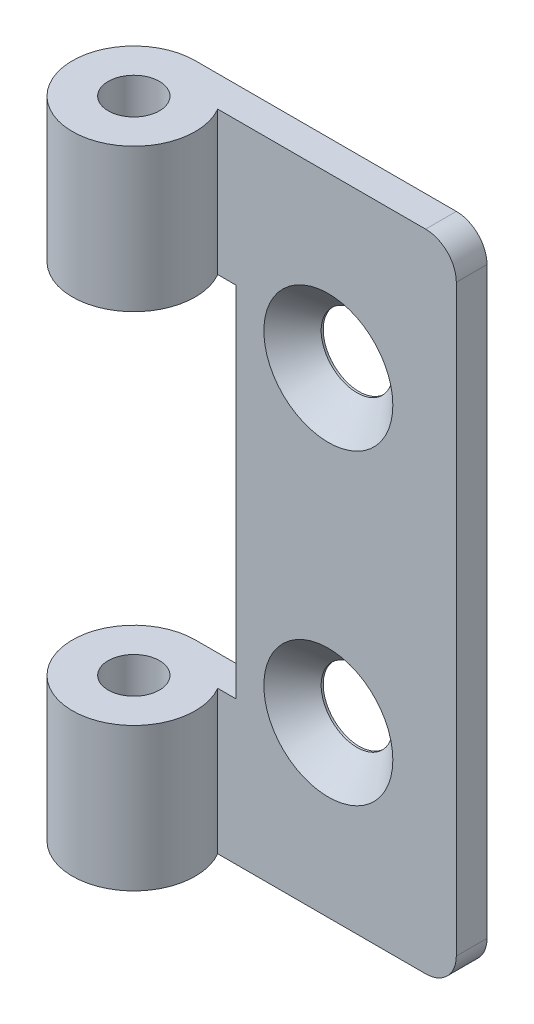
SolidWorks part; units mm, degrees
ref_plane "正面" through (0, 0, 0) normal (0, 0, 1) x (1, 0, 0)
ref_plane "平面" through (0, 0, 0) normal (0, 1, 0) x (1, 0, 0)
ref_plane "右側面" through (0, 0, 0) normal (1, 0, 0) x (0, 0, -1)
sketch "ｽｹｯﾁ1" plane through (0, 0, 0) normal (0, 1, 0) x (1, 0, 0)
  line L1 (0, 6) -> (28.5, 6)
  line L3 (5.1962, 3) -> (28.5, 3)
  line L4 (28.5, 6) -> (28.5, 3)
  arc A0 (0, 6) -> (5.1962, 3) centre (0, 0) ccw
  dimension "D1" = 3
  dimension "D2" = 28.5
extrude "押し出し1" add sketch "ｽｹｯﾁ1" along normal mid plane 63
sketch "ｽｹｯﾁ2" plane through (0, 0, -6) normal (0, 0, -1) x (-1, 0, 0)
  line L1 (6, 31.5) -> (-6, 31.5) construction
  line L2 (11.0013, 17.5) -> (-7, 17.5)
  line L3 (11.0013, 17.5) -> (11.0013, -17.5)
  line L4 (11.0013, -17.5) -> (-7, -17.5)
  line L5 (-7, 17.5) -> (-7, -17.5)
  line L6 (-6, -31.5) -> (6, -31.5) construction
  line L7 (-6, 31.5) -> (-6, -31.5) construction
  dimension "D1" = 14
  dimension "D2" = 14
  dimension "D3" = 1
extrude "押し出し2" cut sketch "ｽｹｯﾁ2" against normal through all
fillet "ﾌｨﾚｯﾄ2" radius 3 2 edges at (28.5, -31.5, -4.5) (28.5, 31.5, -4.5)
hole_wizard "M6 平皿頭ねじ用皿穴1" positions "3Dｽｹｯﾁ2" profile "ｽｹｯﾁ4" countersink size "M6" standard "JIS"
sketch3d "3Dｽｹｯﾁ2"
  line L0 (5.1962, 31.5, -3) -> (25.5, 31.5, -3) construction
  line L1 (28.5, 28.5, -3) -> (28.5, -28.5, -3) construction
  point P0 (16, 15, -3)
  point P2 (16, -15, -3)
  dimension "D1" = 16.5
  dimension "D2" = 12.5
  dimension "D3" = 30
sketch "ｽｹｯﾁ4" plane through (16, 15, -3) normal (1, 0, 0) x (0, -1, 0)
  line L0 (0, 0) -> (0, 3)
  line L1 (0, 3) -> (3.5, 3)
  line L2 (3.5, 3) -> (3.5, 2.8)
  line L3 (3.5, 2.8) -> (6.3, 0)
  line L5 (6.3, 0) -> (0, 0)
  line L6 (-3.5, 2.8) -> (-6.3, 0) construction
  line L11 (0, -6.35) -> (0, 107.95) construction
  dimension "通し穴の直径" = 7
  dimension "通し穴の深さ" = 3
  dimension "表面の皿穴の直径" = 12.6
  dimension "表面の皿穴の角度" = 90
sketch "ｽｹｯﾁ5" plane through (0, 31.5, 0) normal (0, 1, 0) x (1, 0, 0)
  circle A0 centre (0, 0) radius 2.5
extrude "押し出し3" cut sketch "ｽｹｯﾁ5" against normal through all
